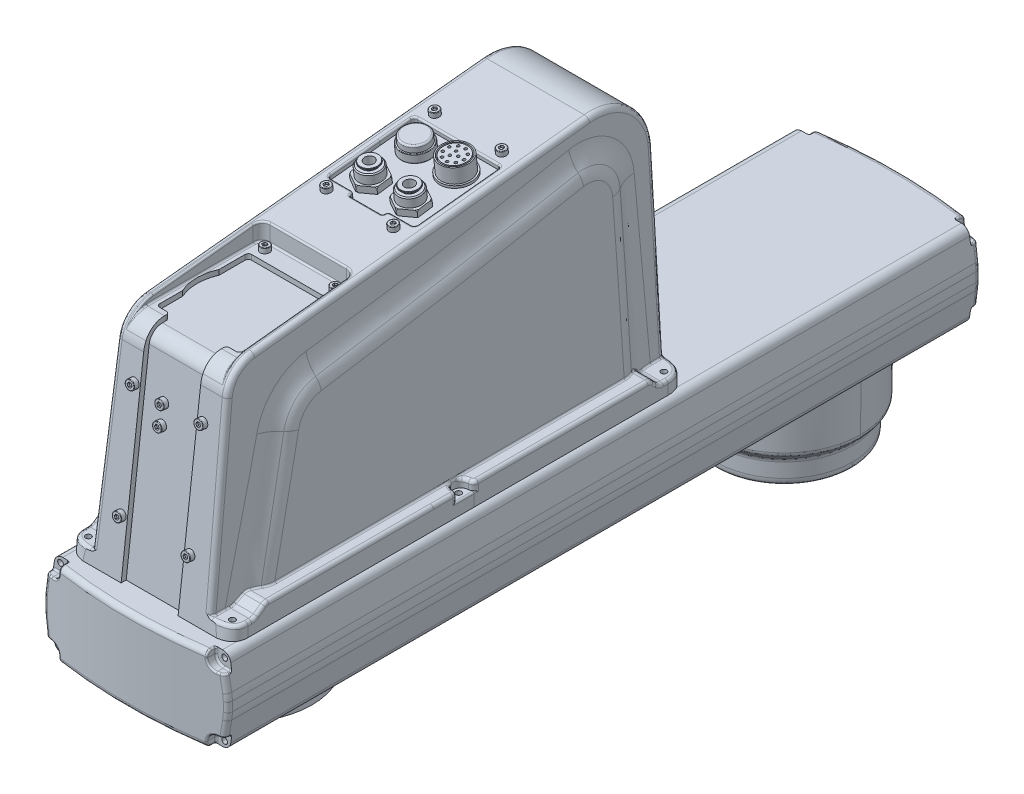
SolidWorks part; units mm, degrees
ref_plane "前视基准面" through (0, 0, 0) normal (0, 0, 1) x (1, 0, 0)
ref_plane "上视基准面" through (0, 0, 0) normal (0, 1, 0) x (1, 0, 0)
ref_plane "右视基准面" through (0, 0, 0) normal (1, 0, 0) x (0, 0, -1)
imported_body "MB10SC-700.sldasm-Part-1-1-solid1"
imported_body "MB10SC-700.sldasm-Part-2-1-solid1"
imported_body "MB10SC-700.sldasm-Part-3-1-solid1"
imported_body "MB10SC-700.sldasm-Part-4-1-solid1"
imported_body "MB10SC-700.sldasm-Part-5-1-solid1"
imported_body "MB10SC-700.sldasm-Part-7-1-solid1"
imported_body "MB10SC-700.sldasm-Part-8-1-solid1"
imported_body "MB10SC-700.sldasm-Part-9-1-surface1"
imported_body "MB10SC-700.sldasm-Part-9-1-surface2"
imported_body "MB10SC-700.sldasm-Part-9-1-surface3"
imported_body "MB10SC-700.sldasm-Part-9-1-surface4"
imported_body "MB10SC-700.sldasm-Part-9-1-surface5"
imported_body "MB10SC-700.sldasm-Part-9-1-surface6"
imported_body "MB10SC-700.sldasm-Part-9-1-surface7"
imported_body "MB10SC-700.sldasm-Part-9-1-surface8"
imported_body "MB10SC-700.sldasm-Part-9-1-surface9"
imported_body "MB10SC-700.sldasm-Part-9-1-surface10"
imported_body "MB10SC-700.sldasm-Part-9-1-surface11"
imported_body "MB10SC-700.sldasm-Part-9-1-surface12"
imported_body "MB10SC-700.sldasm-Part-9-1-surface13"
imported_body "MB10SC-700.sldasm-Part-9-1-surface14"
imported_body "MB10SC-700.sldasm-Part-10-1-solid1"
delete or keep bodies "实体-删除/保留 2" type delete bodies bodies 109 131 113 115 117 118 111 110
delete or keep bodies "实体-删除/保留 3" type delete bodies bodies 116
